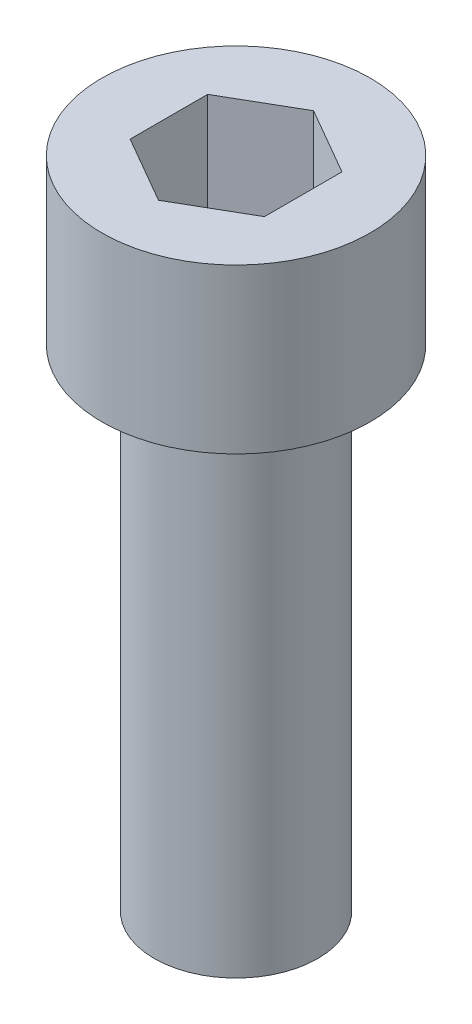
SolidWorks part; units mm, degrees
other "<SHCS_5x.375L>-<Cut-Extrude1>"
ref_plane "Front" through (0, 0, 0) normal (0, 0, 1) x (1, 0, 0)
ref_plane "Top" through (0, 0, 0) normal (0, 1, 0) x (1, 0, 0)
ref_plane "Right" through (0, 0, 0) normal (1, 0, 0) x (0, 0, -1)
mirrored part "SHCS_5x.375L_Mirrored"
